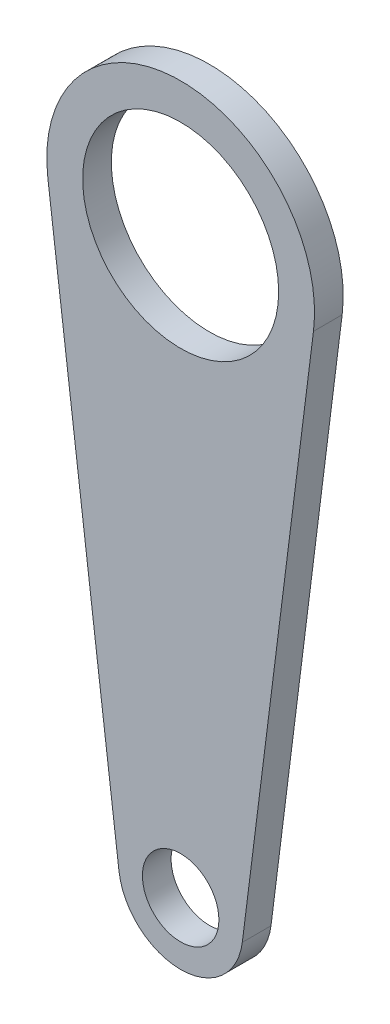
SolidWorks part; units mm, degrees
ref_plane "Plan1" through (0, 0, 0) normal (0, 0, 1) x (1, 0, 0)
ref_plane "Plan2" through (0, 0, 0) normal (0, 1, 0) x (1, 0, 0)
ref_plane "Plan3" through (0, 0, 0) normal (1, 0, 0) x (0, 0, -1)
sketch "Esquisse1" plane through (0, 0, 0) normal (0, 0, 1) x (1, 0, 0)
  line L0 (0, 60) -> (0, -87.6475) construction
  line L1 (-13.8902, 58.25) -> (-6.449, -0.8125)
  line L2 (13.8902, 58.25) -> (6.449, -0.8125)
  circle A0 centre (0, 60) radius 10.25
  circle A1 centre (0, 0) radius 4
  arc A2 (13.8902, 58.25) -> (-13.8902, 58.25) centre (0, 60) ccw
  arc A3 (-6.449, -0.8125) -> (6.449, -0.8125) centre (0, 0) ccw
  dimension "D1" = 20.5
  dimension "D2" = 8
  dimension "D4" = 14
  dimension "D5" = 6.5
  dimension "D3" = 60
extrude "Base-Extrusion" add sketch "Esquisse1" along normal mid plane 3
